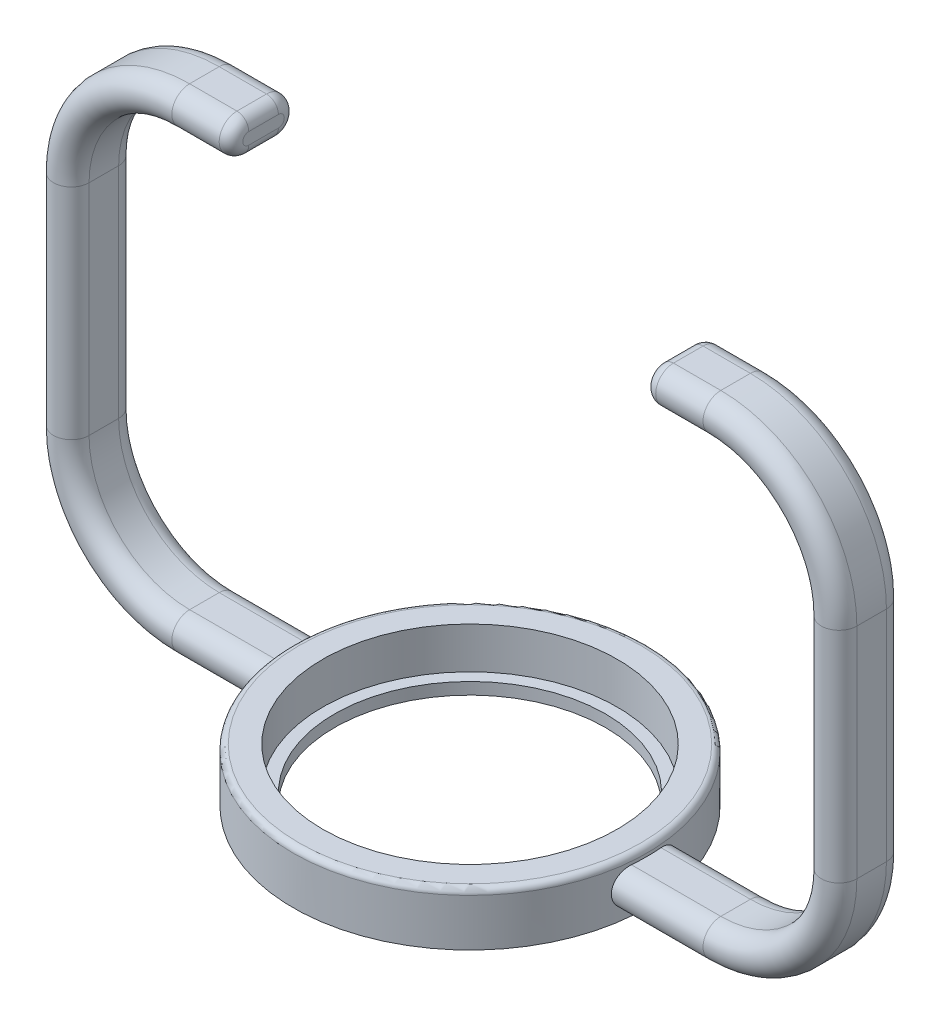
SolidWorks part; units mm, degrees
ref_plane "Front Plane" through (0, 0, 0) normal (0, 0, 1) x (1, 0, 0)
ref_plane "Top Plane" through (0, 0, 0) normal (0, 1, 0) x (1, 0, 0)
ref_plane "Right Plane" through (0, 0, 0) normal (1, 0, 0) x (0, 0, -1)
sketch "Sketch2" plane through (0, 0, 0) normal (0, 1, 0) x (1, 0, 0)
  circle A0 centre (0, 0) radius 24.9
  circle A1 centre (0, 0) radius 29.9
  dimension "D1" = 49.8
  dimension "D2" = 5
extrude "Boss-Extrude1" add sketch "Sketch2" along normal blind 7
sketch "Sketch3" plane through (0, 0, 0) normal (0, -1, 0) x (1, 0, 0)
  circle A0 centre (0, 0) radius 22.9
  circle A1 centre (0, 0) radius 24.9 construction
  circle A2 centre (0, 0) radius 29.9 construction
  circle A3 centre (0, 0) radius 29.9
  dimension "D1" = 2
extrude "Boss-Extrude2" add sketch "Sketch3" along normal blind 2
sketch "Sketch4" plane through (0, 0, 0) normal (1, 0, 0) x (0, 0, -1)
  line L0 (0, -2) -> (0, 79.5) construction
  line L1 (-29.9, -2) -> (29.9, -2) construction
  line L2 (0, 55) -> (0, -55) construction
  dimension "D1" = 81.5
ref_plane "Plane1" through (0, 79.5, 0) normal (0, 1, 0) x (1, 0, 0)
sketch "Sketch6" plane through (0, 79.5, 0) normal (0, 1, 0) x (1, 0, 0)
  circle A0 centre (0, 0) radius 30 construction
  dimension "D1" = 60
sketch "Sketch7" plane through (0, 0, 0) normal (0, 0, 1) x (1, 0, 0)
  line L0 (29.9, 2.5) -> (44.9, 2.5)
  line L1 (29.9, -2) -> (29.9, 7) construction
  line L2 (64.9, 22.5) -> (64.9, 59.5)
  line L3 (30, 79.5) -> (44.9, 79.5)
  arc A0 (44.9, 2.5) -> (64.9, 22.5) centre (44.9, 22.5) ccw
  arc A1 (44.9, 79.5) -> (64.9, 59.5) centre (44.9, 59.5) cw
  point P8 (64.9, 2.5)
  dimension "D2" = 20
  dimension "D1" = 35
ref_plane "Plane2" through (30, 79.5, 0) normal (1, 0, 0) x (0, 0, -1)
sketch "Sketch8" plane through (30, 79.5, 0) normal (1, 0, 0) x (0, 0, -1)
  line L0 (2.5, 0) -> (-2.5, 0) construction
  line L1 (2.5, -3) -> (-2.5, -3)
  line L2 (2.5, 3) -> (-2.5, 3)
  arc A0 (2.5, -3) -> (2.5, 3) centre (2.5, 0) ccw
  arc A1 (-2.5, 3) -> (-2.5, -3) centre (-2.5, 0) ccw
  point P2 (0, 0)
  dimension "D2" = 5
  dimension "D1" = 6
sweep "Sweep1" add profiles "Sketch8" path "Sketch7"
sketch "Sketch9" plane through (29.9, 0, 0) normal (-1, 0, 0) x (0, 0, 1)
  line L2 (-2.5, -0.5) -> (2.5, -0.5)
  line L3 (2.5, 5.5) -> (-2.5, 5.5)
  line L4 (-2.5, -0.5) -> (2.5, -0.5)
  line L5 (2.5, 5.5) -> (-2.5, 5.5)
  arc A2 (-2.5, 5.5) -> (-2.5, -0.5) centre (-2.5, 2.5) ccw
  arc A3 (2.5, -0.5) -> (2.5, 5.5) centre (2.5, 2.5) ccw
  arc A4 (-2.5, 5.5) -> (-2.5, -0.5) centre (-2.5, 2.5) ccw
  arc A5 (2.5, -0.5) -> (2.5, 5.5) centre (2.5, 2.5) ccw
  dimension "D1" = 0
extrude "Boss-Extrude3" add sketch "Sketch9" along normal blind 2
sketch "Sketch10" plane through (0, 82.5, 0) normal (0, 1, 0) x (1, 0, 0)
  line L0 (34.9, 10.3405) -> (34.9, -11.9677)
  line L1 (44.9, 2.5) -> (44.9, -2.5) construction
  dimension "D1" = 10
split "Split1" trim tools "Sketch10" bodies to split 104 resulting bodies 107
fillet "Fillet1" radius 2 4 edges at (34.9, 82.5, 0) (34.9, 79.5, -5.5) (34.9, 76.5, 0) (34.9, 79.5, 5.5)
fillet "Fillet2" radius 1 1 edges at (0, 7, 29.9)
mirror "Mirror3" about plane through (0, 0, 0) normal (1, 0, 0)
combine bodies "Combine1" operation type add bodies to combine 102 108 107
